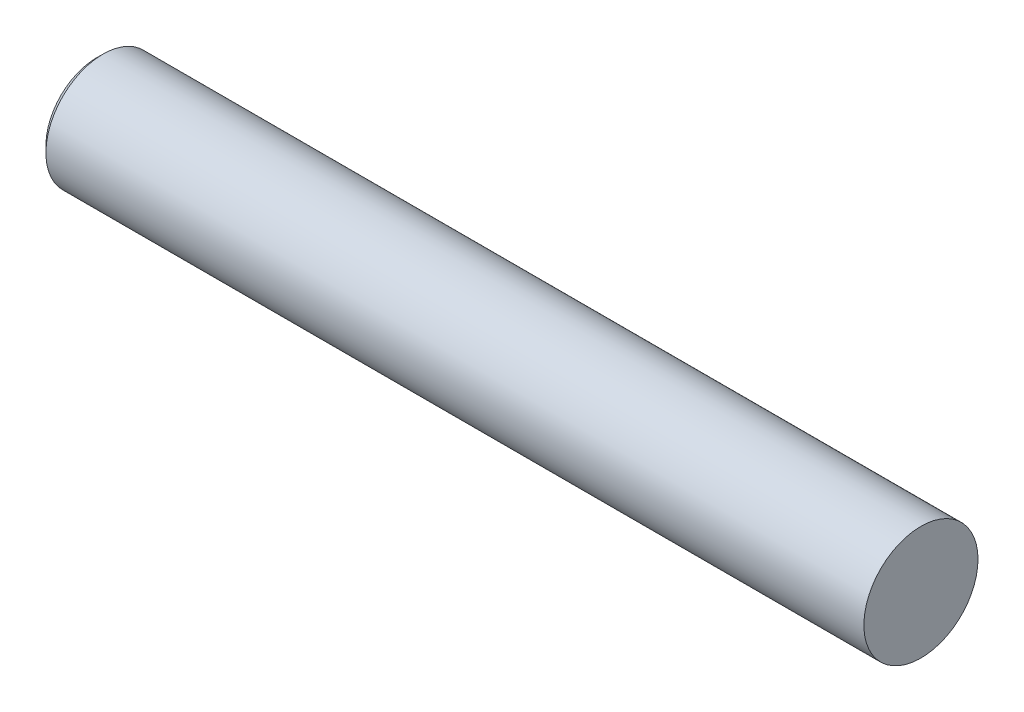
SolidWorks part; units mm, degrees
ref_plane "Front" through (0, 0, 0) normal (0, 0, 1) x (1, 0, 0)
ref_plane "Top" through (0, 0, 0) normal (0, 1, 0) x (1, 0, 0)
ref_plane "Right" through (0, 0, 0) normal (1, 0, 0) x (0, 0, -1)
sketch "Sketch1" plane through (0, 0, 0) normal (1, 0, 0) x (0, 0, -1)
  circle A0 centre (0, 0) radius 9
  dimension "D1" = 18
extrude "Boss-Extrude1" add sketch "Sketch1" along normal blind 130
chamfer "Chamfer1" distance 1 angle 45 1 edges at (0, 0, -9)
